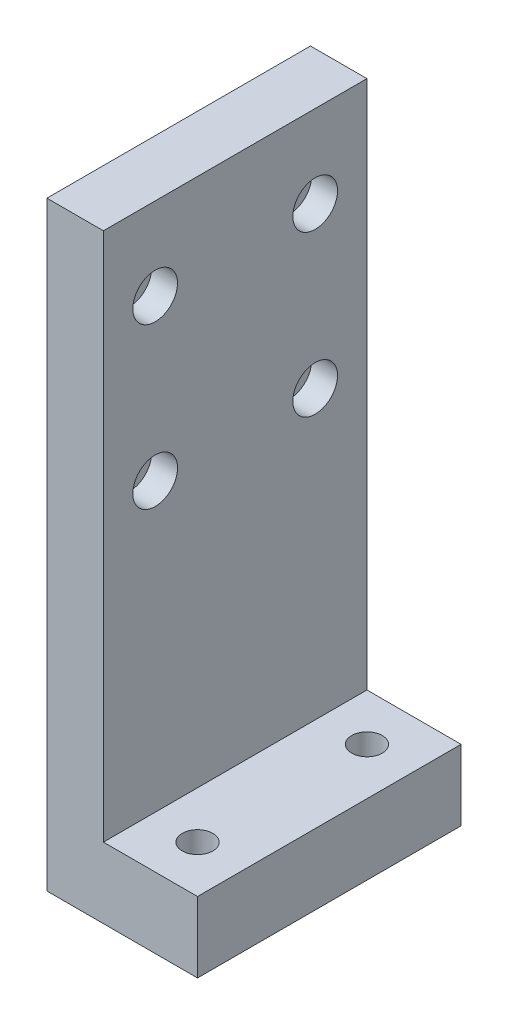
SolidWorks part; units mm, degrees
ref_plane "前视基准面" through (0, 0, 0) normal (0, 0, 1) x (1, 0, 0)
ref_plane "上视基准面" through (0, 0, 0) normal (0, 1, 0) x (1, 0, 0)
ref_plane "右视基准面" through (0, 0, 0) normal (1, 0, 0) x (0, 0, -1)
sketch "草图1" plane through (0, 0, 0) normal (0, 0, 1) x (1, 0, 0)
  line L0 (0, 0) -> (0, 127.5)
  line L1 (12, 15) -> (12, 127.5)
  line L2 (32, 0) -> (32, 15)
  line L3 (0, 0) -> (32, 0)
  line L4 (12, 15) -> (32, 15)
  line L5 (0, 127.5) -> (12, 127.5)
extrude "凸台-拉伸1" add sketch "草图1" along normal blind 56
sketch "草图2" plane through (12, 0, 0) normal (1, 0, 0) x (0, 0, -1)
  circle A0 centre (-45, 110) radius 2.75
  circle A1 centre (-11, 110) radius 2.75
  circle A2 centre (-11, 76) radius 2.75
  circle A3 centre (-45, 76) radius 2.75
extrude "切除-拉伸1" cut sketch "草图2" against normal blind 56
sketch "草图3" plane through (12, 0, 0) normal (1, 0, 0) x (0, 0, -1)
  circle A0 centre (-45, 110) radius 4.75
  circle A1 centre (-11, 110) radius 4.75
  circle A2 centre (-11, 76) radius 4.75
  circle A3 centre (-45, 76) radius 4.75
extrude "切除-拉伸2" cut sketch "草图3" against normal blind 5.5
sketch "草图4" plane through (0, 127.5, 0) normal (0, 1, 0) x (1, 0, 0)
  circle A0 centre (22, -10) radius 3.25
  circle A1 centre (22, -46) radius 3.25
extrude "切除-拉伸3" cut sketch "草图4" against normal through all
